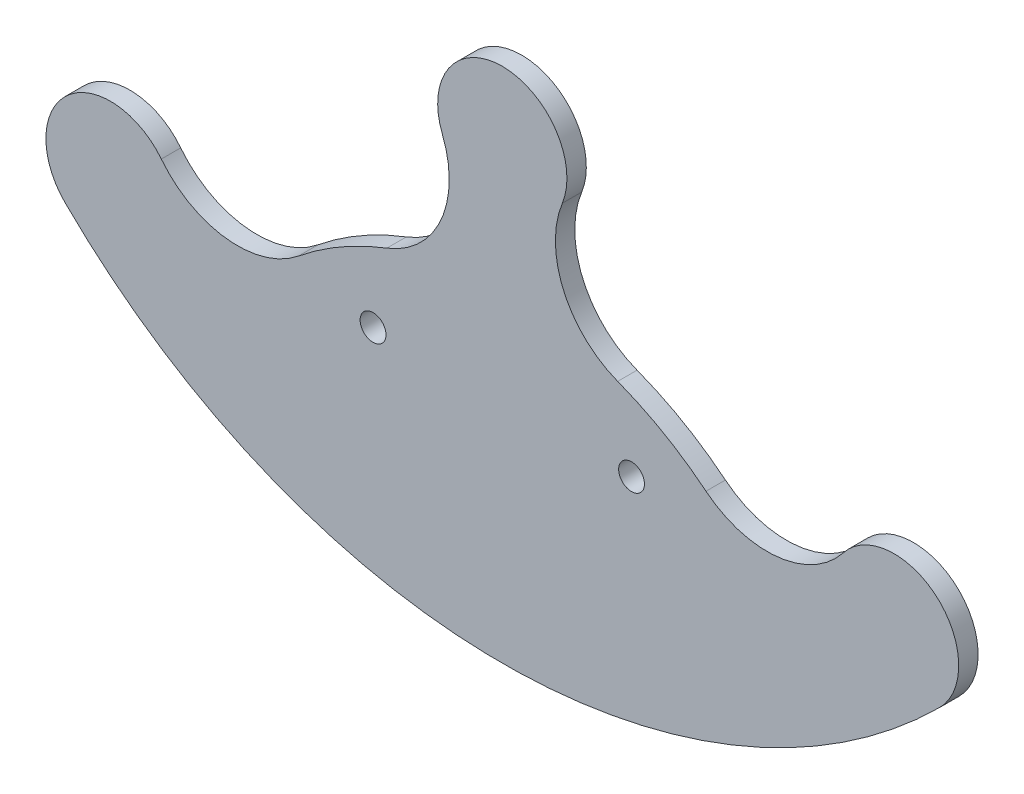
SolidWorks part; units mm, degrees
ref_plane "Front Plane" through (0, 0, 0) normal (0, 0, 1) x (1, 0, 0)
ref_plane "Top Plane" through (0, 0, 0) normal (0, 1, 0) x (1, 0, 0)
ref_plane "Right Plane" through (0, 0, 0) normal (1, 0, 0) x (0, 0, -1)
sketch "Sketch2" plane through (0, 0, 0) normal (0, 0, 1) x (1, 0, 0)
  line L0 (0, 0) -> (-50, 0) construction
  line L1 (0, -44.7214) -> (0, 96) construction
  line L2 (0, 0) -> (-60.6218, 35) construction
  line L4 (0, 0) -> (-40.9743, 50.4589) construction
  line L5 (0, 0) -> (-23.2115, 60.7143) construction
  arc A0 (-17.855, 46.7033) -> (-31.5187, 38.8146) centre (0, 0) ccw
  arc A1 (-67.6708, 27.907) -> (67.6708, 27.907) centre (0, 96) ccw
  arc A2 (17.855, 46.7033) -> (9.2846, 66.2857) centre (23.2115, 60.7143) cw
  arc A3 (-52.7628, 41.1836) -> (-67.6708, 27.907) centre (-60.6218, 35) ccw
  arc A4 (17.855, 46.7033) -> (31.5187, 38.8146) centre (0, 0) cw
  arc A5 (9.2846, 66.2857) -> (-9.2846, 66.2857) centre (0, 70) ccw
  arc A6 (0, 70) -> (-60.6218, 35) centre (0, 0) ccw construction
  arc A7 (52.7628, 41.1836) -> (31.5187, 38.8146) centre (40.9743, 50.4589) cw
  arc A8 (-17.855, 46.7033) -> (-9.2846, 66.2857) centre (-23.2115, 60.7143) ccw
  arc A9 (-52.7628, 41.1836) -> (-31.5187, 38.8146) centre (-40.9743, 50.4589) ccw
  arc A10 (52.7628, 41.1836) -> (67.6708, 27.907) centre (60.6218, 35) cw
  circle A11 centre (-20, 35) radius 2
  circle A12 centre (20, 35) radius 2
  arc A18 (0, 65) -> (-63.943, 11.6745) centre (0, 0) ccw construction
  dimension "D1" = 96
  dimension "D5" = 30
  dimension "D6" = 70
  dimension "D7" = 65
  dimension "D8" = 4
  dimension "D4" = 10
  dimension "D2" = 15
  dimension "D3" = 50
  dimension "D9" = 4
  dimension "D10" = 20
  dimension "D11" = 20
  dimension "D12" = 35
  dimension "D13" = 35
extrude "Extrude1" add sketch "Sketch2" along normal blind 3
